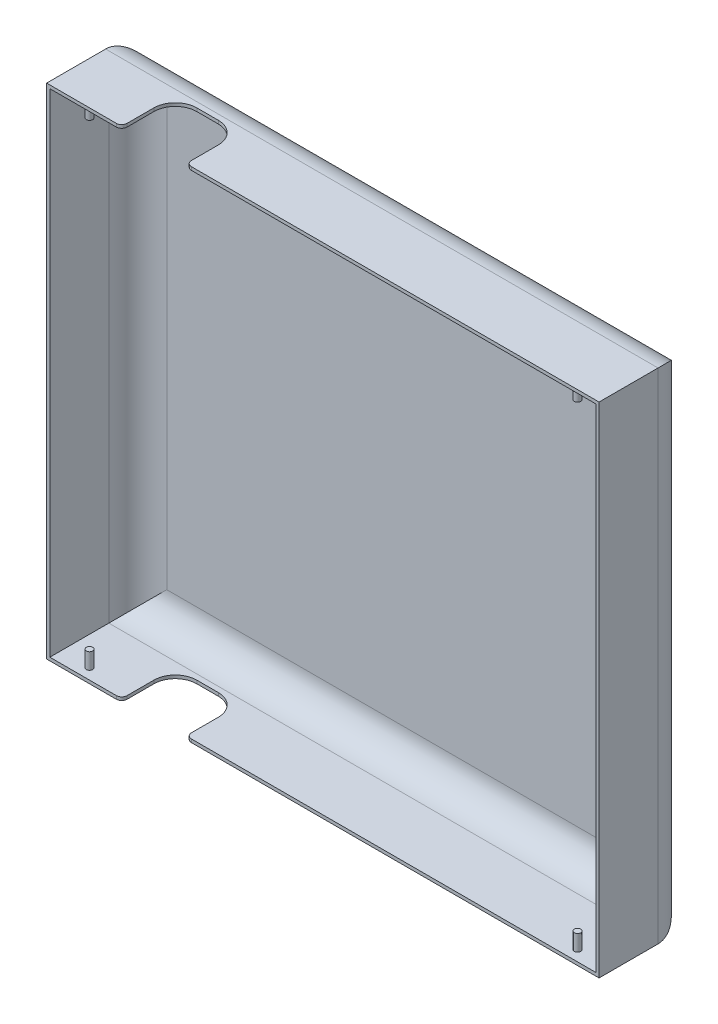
SolidWorks part; units mm, degrees
ref_plane "Face" through (0, 0, 0) normal (0, 0, 1) x (1, 0, 0)
ref_plane "Dessus" through (0, 0, 0) normal (0, 1, 0) x (1, 0, 0)
ref_plane "Droite" through (0, 0, 0) normal (1, 0, 0) x (0, 0, -1)
sketch "Esquisse1" plane through (0, 0, 0) normal (0, 0, 1) x (1, 0, 0)
  line L1 (0, 0) -> (515, 0)
  line L2 (0, 0) -> (0, -465)
  line L3 (0, -465) -> (515, -465)
  line L4 (515, 0) -> (515, -465)
  dimension "D1" = 465
  dimension "D2" = 515
extrude "Base-Extrusion" add sketch "Esquisse1" along normal blind 85
fillet "Congé1" radius 30
shell "Coque1" thickness 3
sketch "Esquisse2" plane through (0, 0, 0) normal (0, 1, 0) x (-1, 0, 0)
  line L0 (-515, 85) -> (0, 85) construction
  line L1 (-130, 85) -> (-70, 85)
  line L2 (-130, 85) -> (-130, 35)
  line L3 (-130, 35) -> (-70, 35)
  line L4 (-70, 85) -> (-70, 35)
  line L5 (0, 85) -> (0, 30) construction
  dimension "D1" = 70
  dimension "D2" = 50
  dimension "D3" = 60
extrude "Enlèv. mat.-Extru.1" cut sketch "Esquisse2" against normal through all
fillet "Congé2" radius 5
fillet "Congé3" radius 20
fillet "Congé4" radius 20
fillet "Congé5" radius 20
fillet "Congé6" radius 20
fillet "Congé7" radius 5
fillet "Congé8" radius 5
sketch "Esquisse3" plane through (0, -462, 0) normal (0, 1, 0) x (-1, 0, 0)
  line L0 (-533.1042, 75) -> (16.4878, 75) construction
  line L1 (-515, 85) -> (-135, 85) construction
  line L2 (-515, 85) -> (-515, 30) construction
  line L3 (0, 85) -> (0, 30) construction
  circle A0 centre (-30, 75) radius 3
  circle A1 centre (-485, 75) radius 3
  dimension "D2" = 6
  dimension "D3" = 6
  dimension "D1" = 10
  dimension "D4" = 30
  dimension "D5" = 30
extrude "Boss.-Extru.1" add sketch "Esquisse3" along normal blind 15
sketch "Esquisse4" plane through (0, -3, 0) normal (0, -1, 0) x (1, 0, 0)
  line L0 (556.1148, 75) -> (-32.7473, 75) construction
  line L1 (135, 85) -> (515, 85) construction
  line L2 (0, 85) -> (0, 30) construction
  line L3 (515, 85) -> (515, 30) construction
  circle A0 centre (30, 75) radius 3
  circle A1 centre (485, 75) radius 3
  dimension "D2" = 6
  dimension "D3" = 6
  dimension "D1" = 10
  dimension "D4" = 30
  dimension "D5" = 30
extrude "Boss.-Extru.2" add sketch "Esquisse4" along normal blind 15
